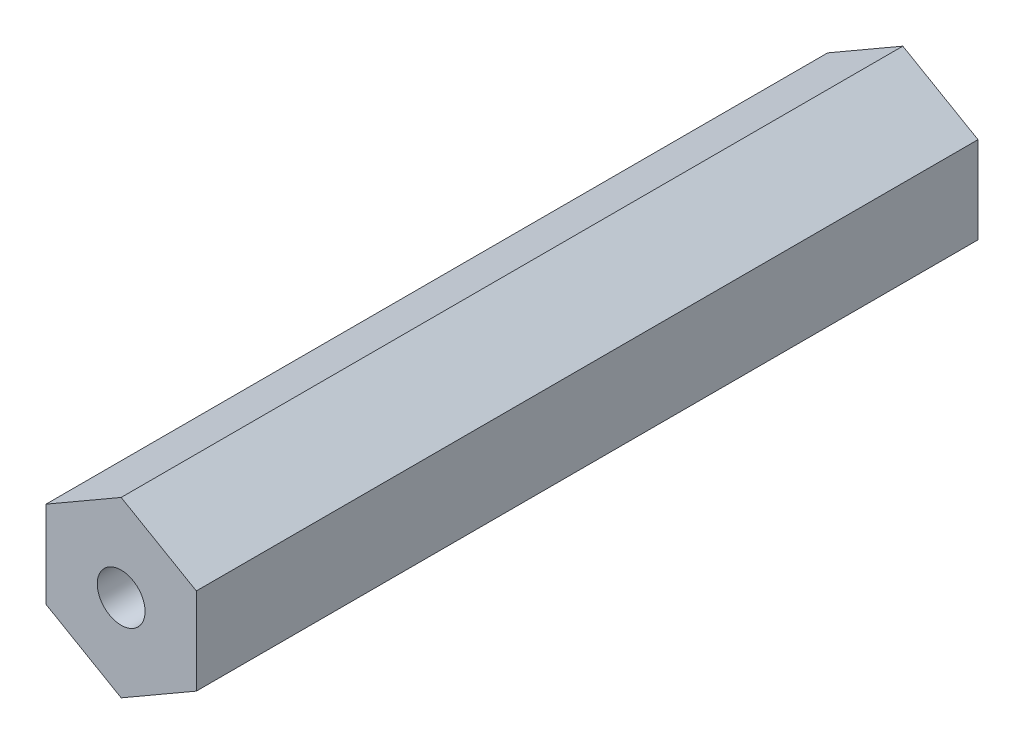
SolidWorks part; units mm, degrees
ref_plane "Front Plane" through (0, 0, 0) normal (0, 0, 1) x (1, 0, 0)
ref_plane "Top Plane" through (0, 0, 0) normal (0, 1, 0) x (1, 0, 0)
ref_plane "Right Plane" through (0, 0, 0) normal (1, 0, 0) x (0, 0, -1)
sketch "Sketch1" plane through (0, 0, 0) normal (0, 0, 1) x (1, 0, 0)
  line L1 (0, 7.3323) -> (-6.35, 3.6662)
  line L2 (-6.35, 3.6662) -> (-6.35, -3.6662)
  line L3 (-6.35, -3.6662) -> (0, -7.3323)
  line L4 (0, -7.3323) -> (6.35, -3.6662)
  line L5 (6.35, -3.6662) -> (6.35, 3.6662)
  line L6 (6.35, 3.6662) -> (0, 7.3323)
  circle A0 centre (0, 0) radius 6.35 construction
  dimension "D1" = 12.7
extrude "Boss-Extrude1" add sketch "Sketch1" along normal blind 66.04
hole_wizard "Tap Drill for #10-32 Tap1" positions "Sketch3" profile "Sketch2" hole size "#10-32" standard "ANSI Inch"
sketch "Sketch3" plane through (0, 0, 0) normal (0, 0, -1) x (-1, 0, 0)
  point P0 (0, 0)
sketch "Sketch2" plane through (0, 0, 0) normal (1, 0, 0) x (0, 1, 0)
  line L0 (0, 0) -> (0, 13.9133)
  line L1 (0, 13.9133) -> (2.0193, 12.7)
  line L2 (2.0193, 12.7) -> (2.0193, 0)
  line L5 (2.0193, 0) -> (0, 0)
  line L10 (0, 13.9133) -> (-2.0193, 12.7) construction
  line L11 (0, -6.35) -> (0, 107.95) construction
  dimension "Hole Dia." = 4.0386
  dimension "Hole Depth" = 12.7
  dimension "Drill Angle" = 118
hole_wizard "Tap Drill for #10-32 Tap2" positions "3DSketch1" profile "Sketch4" hole size "#10-32" standard "ANSI Inch"
sketch3d "3DSketch1"
  line L0 (-6.35, 3.6662, 66.04) -> (6.35, -3.6662, 66.04) construction
  line L1 (0, 7.3323, 66.04) -> (0, -7.3323, 66.04) construction
  point P21 (0, 0, 66.04)
  point P23 (0, 0, 66.04)
  point P25 (0, 0, 66.04)
  point P27 (0, 0, 66.04)
  point P29 (0, 0, 66.04)
  point P31 (0, 0, 66.04)
  point P33 (0, 0, 66.04)
  point P35 (0, 0, 66.04)
  point P37 (0, 0, 66.04)
sketch "Sketch4" plane through (0, 0, 66.04) normal (1, 0, 0) x (0, -1, 0)
  line L0 (0, 0) -> (0, 13.9133)
  line L1 (0, 13.9133) -> (2.0193, 12.7)
  line L2 (2.0193, 12.7) -> (2.0193, 0)
  line L5 (2.0193, 0) -> (0, 0)
  line L10 (0, 13.9133) -> (-2.0193, 12.7) construction
  line L11 (0, -6.35) -> (0, 107.95) construction
  dimension "Hole Dia." = 4.0386
  dimension "Hole Depth" = 12.7
  dimension "Drill Angle" = 118
